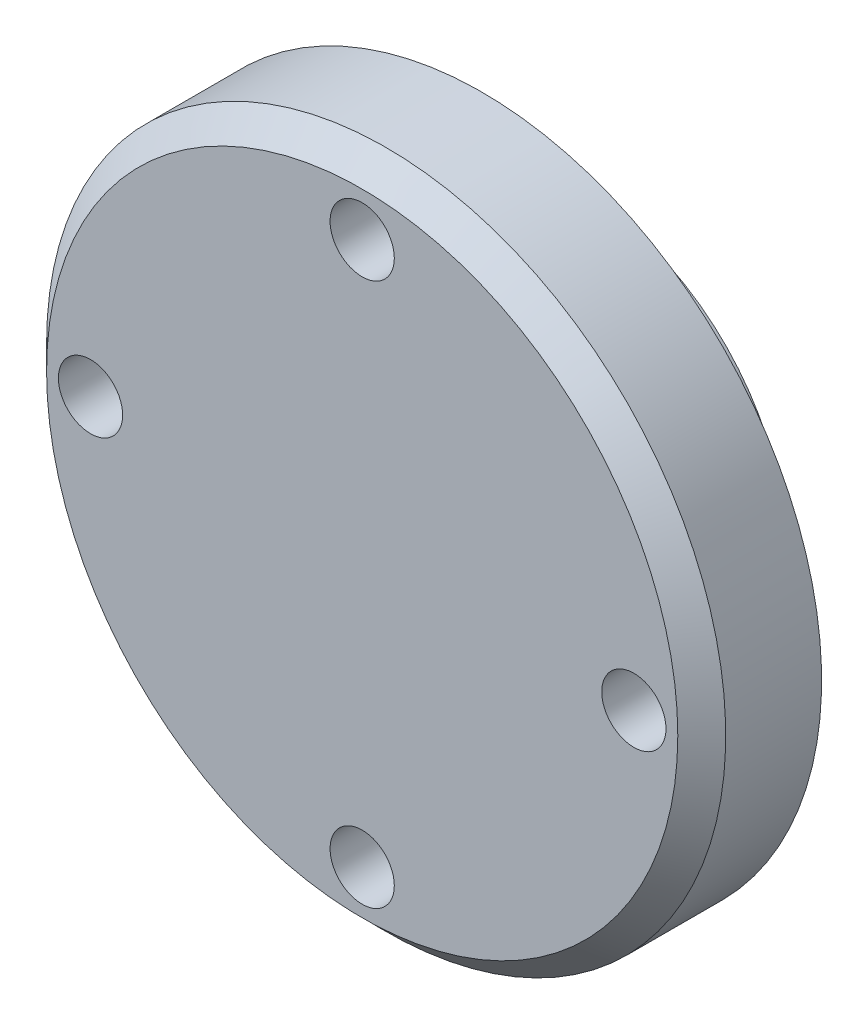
SolidWorks part; units mm, degrees
ref_plane "Front Plane" through (0, 0, 0) normal (0, 0, 1) x (1, 0, 0)
ref_plane "Top Plane" through (0, 0, 0) normal (0, 1, 0) x (1, 0, 0)
ref_plane "Right Plane" through (0, 0, 0) normal (1, 0, 0) x (0, 0, -1)
sketch "Sketch1" plane through (0, 0, 0) normal (0, 0, 1) x (1, 0, 0)
  circle A0 centre (0, 0) radius 26.9875
  dimension "D1" = 53.975
extrude "Boss-Extrude1" add sketch "Sketch1" along normal blind 9.525
sketch "Sketch3" plane through (0, 0, 0) normal (0, 0, -1) x (-1, 0, 0)
  circle A0 centre (0, 0) radius 16.5227
  dimension "D1" = 33.0454
extrude "Boss-Extrude2" add sketch "Sketch3" along normal blind 7.62
sketch "Sketch4" plane through (0, 0, 0) normal (0, 1, 0) x (1, 0, 0)
  line L0 (-16.5227, 2.413) -> (-15.1765, 2.413)
  line L1 (-16.5227, 7.62) -> (-16.5227, 0) construction
  line L2 (-15.1765, 2.413) -> (-15.1765, 5.08)
  line L3 (-15.1765, 5.08) -> (-16.5227, 5.08)
  line L4 (16.5227, 7.62) -> (-16.5227, 7.62) construction
  line L5 (-16.5227, 2.413) -> (-16.5227, 5.08)
  dimension "D1" = 2.54
  dimension "D2" = 1.3462
  dimension "D3" = 2.667
ref_axis "Axis1" through (0, 0, -8.4772) along (0, 0, 1)
revolve "Cut-Revolve3" cut sketch "Sketch4" angle 360 about axis through (0, 0, -8.4772) along (0, 0, 1)
hole_wizard "#10 Clearance Hole1" positions "Sketch6" profile "Sketch5" hole size "#10" standard "ANSI Inch"
sketch "Sketch6" plane through (0, 0, 9.525) normal (0, 0, 1) x (1, 0, 0)
  circle A0 centre (0, 0) radius 21.59
  point P0 (0, -21.59)
  point P2 (21.59, 0)
  point P4 (0, 21.59)
  point P6 (-21.59, 0)
  dimension "D1" = 43.18
sketch "Sketch5" plane through (0, -21.59, 9.525) normal (1, 0, 0) x (0, -1, 0)
  line L0 (0, 0) -> (0, 9.525)
  line L1 (0, 9.525) -> (2.5527, 9.525)
  line L2 (2.5527, 9.525) -> (2.5527, 0)
  line L5 (2.5527, 0) -> (0, 0)
  line L11 (0, -6.35) -> (0, 107.95) construction
  dimension "Thru Hole Dia." = 5.1054
  dimension "Thru Hole Depth" = 9.525
chamfer "Chamfer1" distance 1.905 angle 45 1 edges at (26.9875, 0, 9.525)
